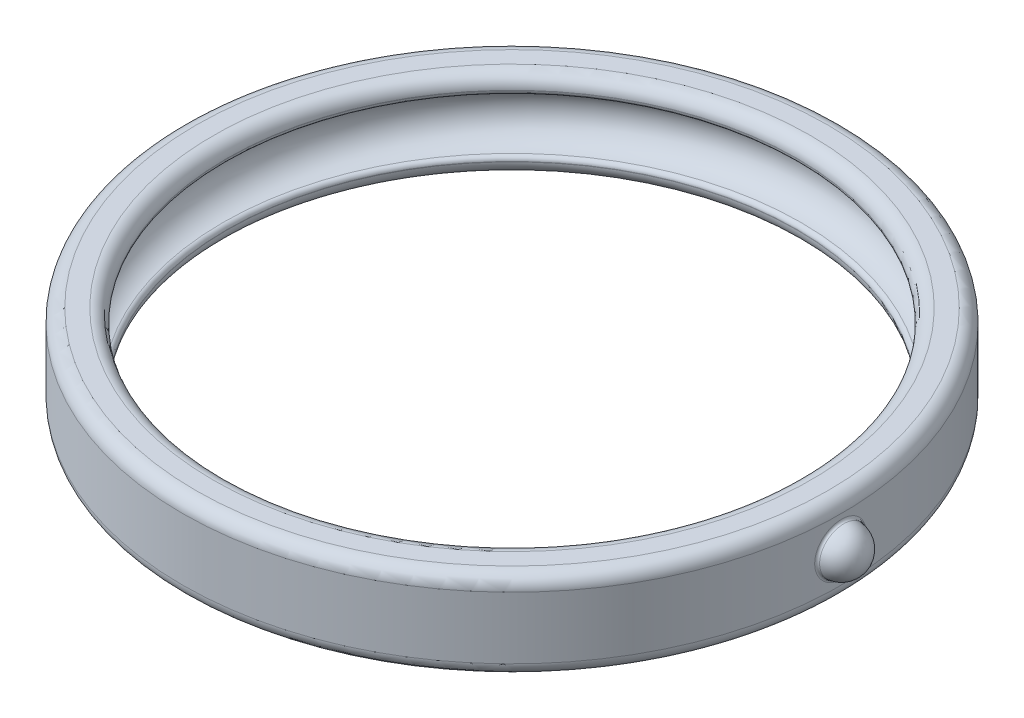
SolidWorks part; units mm, degrees
ref_plane "前视基准面" through (0, 0, 0) normal (0, 0, 1) x (1, 0, 0)
ref_plane "上视基准面" through (0, 0, 0) normal (0, 1, 0) x (1, 0, 0)
ref_plane "右视基准面" through (0, 0, 0) normal (1, 0, 0) x (0, 0, -1)
sketch "草图1" plane through (0, 0, 0) normal (0, 0, 1) x (1, 0, 0)
  line L0 (0, 0) -> (0, 47.0541) construction
  line L1 (32.2, 8.4641) -> (32.2, 8.5)
  line L2 (33.7, 0) -> (35.7, 0)
  line L3 (32.2, 1.5) -> (32.2, 1.5359)
  line L4 (33.7, 10) -> (35.7, 10)
  line L5 (37.2, 1.5) -> (37.2, 8.5)
  arc A0 (32.6286, 2.0308) -> (32.6286, 7.9692) centre (32.2, 5) ccw
  arc A1 (32.2, 8.5) -> (33.7, 10) centre (33.7, 8.5) cw
  arc A2 (33.7, 0) -> (32.2, 1.5) centre (33.7, 1.5) cw
  arc A3 (35.7, 0) -> (37.2, 1.5) centre (35.7, 1.5) ccw
  arc A4 (35.7, 10) -> (37.2, 8.5) centre (35.7, 8.5) cw
  arc A5 (32.6286, 7.9692) -> (32.2, 8.4641) centre (32.7, 8.4641) cw
  arc A6 (32.6286, 2.0308) -> (32.2, 1.5359) centre (32.7, 1.5359) ccw
  point P12 (32.2, 10)
  point P17 (37.2, 0)
  point P20 (37.2, 10)
  point P23 (32.2, 8)
revolve "旋转1" add sketch "草图1" angle 360 about L0
sketch "草图2" plane through (0, 0, 0) normal (0, 0, 1) x (1, 0, 0)
  line L0 (37.2, 1.5) -> (37.2, 8.5) construction
  line L1 (37.2, 5) -> (37.2, -0.5229) construction
  line L2 (37.2, 7.65) -> (37.2, 2.35)
  arc A0 (37.2, 2.35) -> (37.2, 7.65) centre (37.2, 5) ccw
  dimension "D1" = 5.3
revolve "旋转4" add sketch "草图2" angle 110 about L1
sketch "草图3" plane through (0, 0, 0) normal (0, 0, 1) x (1, 0, 0)
  line L0 (-37.2, 8.5) -> (-37.2, 1.5) construction
  line L1 (-37.2, 7.65) -> (-37.2, 2.35)
  line L2 (-37.2, 7.65) -> (-37.2, -1.9068) construction
  arc A0 (-37.2, 7.65) -> (-37.2, 2.35) centre (-37.2, 5) ccw
  dimension "D1" = 5.3
revolve "旋转5" add sketch "草图3" angle 110 about L2
fillet "圆角2" radius 0.3 2 edges at (37.1105, 4.398, 2.5792) (-37.1105, 4.398, -2.5792)
equation "\"len1\"=37.2"
equation "\"len2\"= 45"
equation "\"len3\"= 40"
equation "\"D1@草图1\"=\"len1\""
